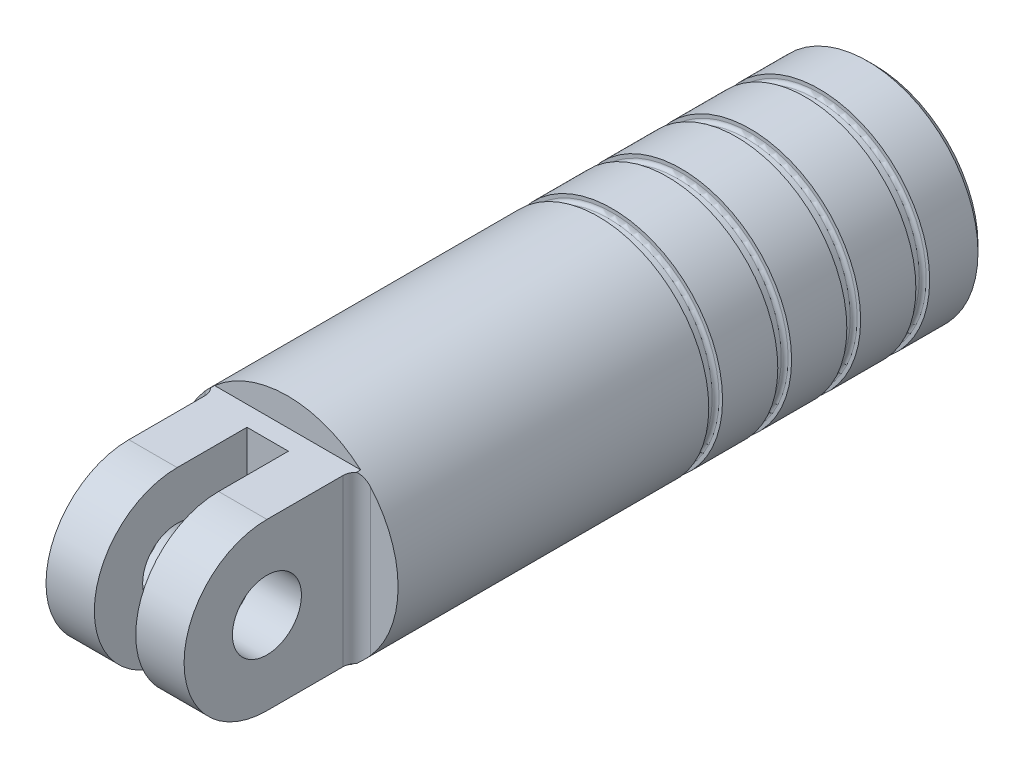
SolidWorks part; units mm, degrees
ref_plane "前视" through (0, 0, 0) normal (0, 0, 1) x (1, 0, 0)
ref_plane "上视" through (0, 0, 0) normal (0, 1, 0) x (1, 0, 0)
ref_plane "右视" through (0, 0, 0) normal (1, 0, 0) x (0, 0, -1)
sketch "草图1" plane through (0, 0, 0) normal (0, 0, 1) x (1, 0, 0)
  circle A0 centre (0, 0) radius 16
  dimension "D1" = 32
extrude "拉伸1" add sketch "草图1" along normal blind 8
sketch "草图2" plane through (0, 0, 8) normal (0, 0, 1) x (1, 0, 0)
  circle A0 centre (0, 0) radius 15
  circle A1 centre (0, 0) radius 16 construction
  dimension "D1" = 30
extrude "拉伸2" add sketch "草图2" along normal blind 2
sketch "草图3" plane through (0, 0, 10) normal (0, 0, 1) x (1, 0, 0)
  circle A0 centre (0, 0) radius 16
  circle A1 centre (0, 0) radius 15 construction
  dimension "D1" = 32
extrude "拉伸3" add sketch "草图3" along normal blind 8
sketch "草图4" plane through (0, 0, 18) normal (0, 0, 1) x (1, 0, 0)
  circle A0 centre (0, 0) radius 15
  circle A1 centre (0, 0) radius 16 construction
  dimension "D1" = 30
extrude "拉伸4" add sketch "草图4" along normal blind 2
sketch "草图5" plane through (0, 0, 20) normal (0, 0, 1) x (1, 0, 0)
  circle A0 centre (0, 0) radius 16
  circle A1 centre (0, 0) radius 15 construction
  dimension "D1" = 32
extrude "拉伸5" add sketch "草图5" along normal blind 8
sketch "草图6" plane through (0, 0, 28) normal (0, 0, 1) x (1, 0, 0)
  circle A0 centre (0, 0) radius 15
  circle A1 centre (0, 0) radius 16 construction
  dimension "D1" = 30
extrude "拉伸6" add sketch "草图6" along normal blind 2
sketch "草图7" plane through (0, 0, 30) normal (0, 0, 1) x (1, 0, 0)
  circle A0 centre (0, 0) radius 16
  circle A1 centre (0, 0) radius 15 construction
  dimension "D1" = 32
extrude "拉伸7" add sketch "草图7" along normal blind 8
sketch "草图8" plane through (0, 0, 38) normal (0, 0, 1) x (1, 0, 0)
  circle A0 centre (0, 0) radius 15
  circle A1 centre (0, 0) radius 16 construction
  dimension "D1" = 30
extrude "拉伸8" add sketch "草图8" along normal blind 2
sketch "草图9" plane through (0, 0, 40) normal (0, 0, 1) x (1, 0, 0)
  circle A0 centre (0, 0) radius 16
  circle A1 centre (0, 0) radius 15 construction
  dimension "D1" = 32
extrude "拉伸9" add sketch "草图9" along normal blind 45
sketch "草图10" plane through (0, 0, 0) normal (1, 0, 0) x (0, 0, -1)
  line L0 (-8, 0) -> (0, 0) construction
  line L2 (-85, 16) -> (-85, -16) construction
  line L3 (-98, 12) -> (-85, 12)
  line L4 (-98, -12) -> (-85, -12)
  line L5 (-85, 12) -> (-85, -12)
  circle A0 centre (-98, 0) radius 5
  arc A1 (-98, 12) -> (-98, -12) centre (-98, 0) ccw
  dimension "D2" = 24
  dimension "D3" = 10
  dimension "D1" = 13
extrude "拉伸10" add sketch "草图10" along normal mid plane 20
sketch "草图11" plane through (0, 12, 0) normal (0, 1, 0) x (-1, 0, 0)
  line L0 (-3, 109.8889) -> (-3, 87.8889)
  line L2 (3, 109.8889) -> (3, 87.8889)
  line L4 (3, 87.8889) -> (-3, 87.8889)
  line L5 (-3, 109.8889) -> (-3, 111.2808)
  line L6 (-3, 111.2808) -> (3, 111.2808)
  line L7 (3, 111.2808) -> (3, 109.8889)
  dimension "D1" = 22
extrude "切除-拉伸1" cut sketch "草图11" against normal through all
fillet "圆角1" radius 2
fillet "圆角2" radius 2
fillet "圆角3" radius 0.5
fillet "圆角4" radius 0.5
fillet "圆角5" radius 0.5
chamfer "倒角1" distance 1 angle 45
